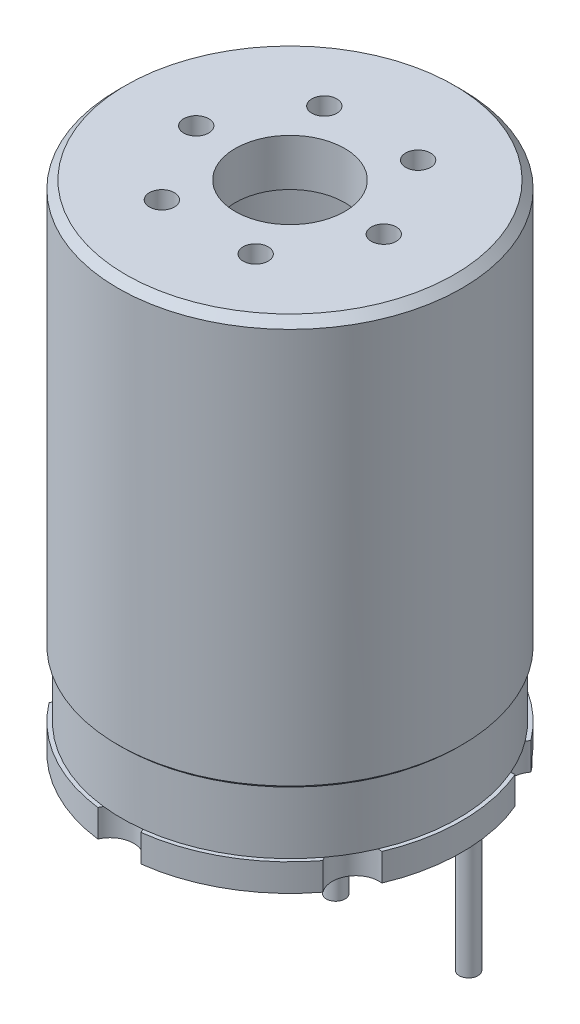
SolidWorks part; units mm, degrees
other "<ALD_M840029__P_Portescap_22NT_82_213P>-<Extrusion26>"
ref_plane "Face" through (0, 0, 0) normal (0, 0, 1) x (1, 0, 0)
ref_plane "Dessus" through (0, 0, 0) normal (0, 1, 0) x (1, 0, 0)
ref_plane "Droite" through (0, 0, 0) normal (1, 0, 0) x (0, 0, -1)
inserted part "ALD_M840029__P_Portescap_22NT_82_213P"
sketch "Esquisse1" plane through (0, 0, 0) normal (0, 0, 1) x (1, 0, 0)
  line L0 (0, 39) -> (-3.5, 39)
  line L1 (-3.5, 39) -> (-3.5, 27)
  line L2 (-3.5, 27) -> (-9.5, 27)
  line L3 (-9.5, 27) -> (-9.5, 5)
  line L4 (-9.5, 5) -> (-5, 5)
  line L5 (-5, 5) -> (-5, 0)
  line L6 (-5, 0) -> (-1, 0)
  line L7 (-1, 0) -> (-1, -12)
  line L8 (-1, -12) -> (0, -12)
  line L9 (0, -12) -> (0, 39)
  line L10 (0, -16.4674) -> (0, 40.4358) construction
  line L11 (10.5, 30) -> (-10.5, 30) construction
  dimension "D1" = 7
  dimension "D2" = 19
  dimension "D3" = 3
  dimension "D4" = 22
  dimension "D5" = 10
  dimension "D6" = 1
  dimension "D7" = 5
  dimension "D8" = 12
  dimension "D9" = 12
revolve "Enlèvement de matière-Révolution1" cut sketch "Esquisse1" angle 360 about L10
